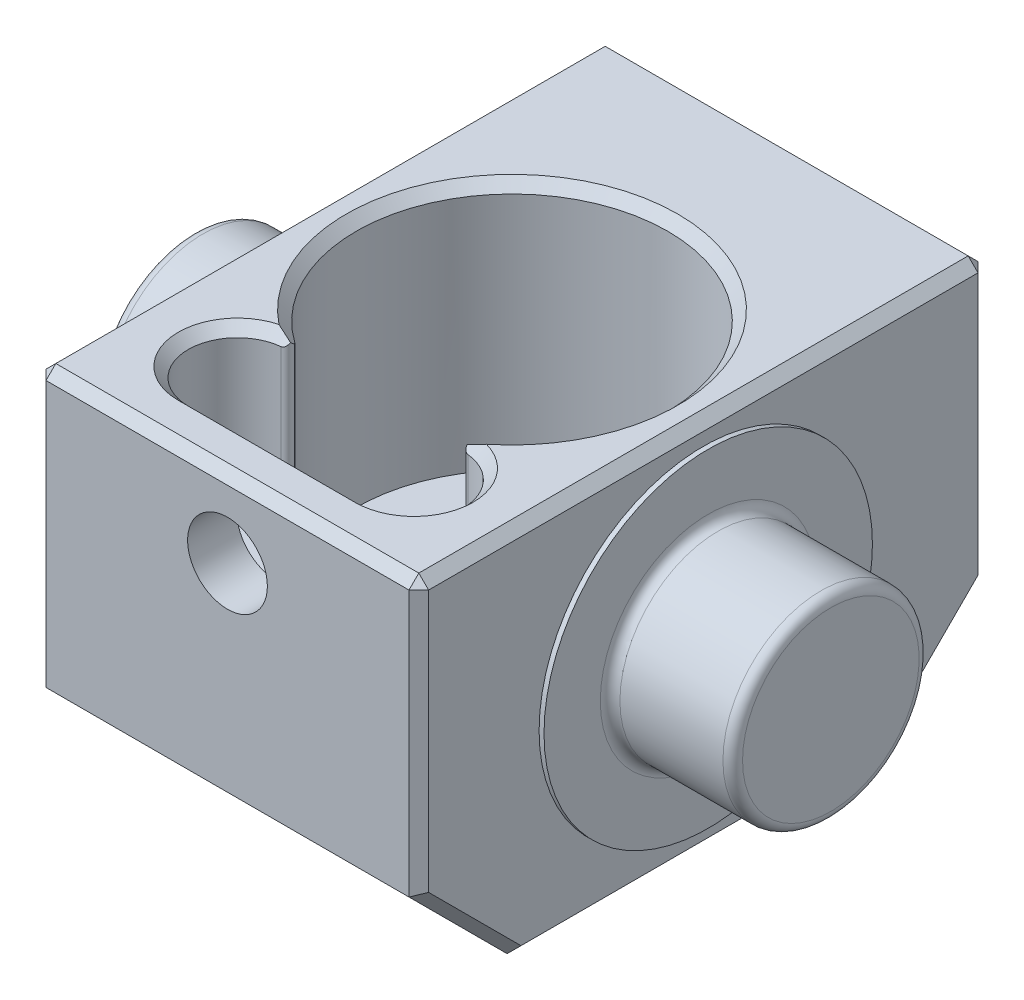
SolidWorks part; units mm, degrees
ref_plane "Front Plane" through (0, 0, 0) normal (0, 0, 1) x (1, 0, 0)
ref_plane "Top Plane" through (0, 0, 0) normal (0, 1, 0) x (1, 0, 0)
ref_plane "Right Plane" through (0, 0, 0) normal (1, 0, 0) x (0, 0, -1)
sketch "Sketch1" plane through (0, 0, 0) normal (1, 0, 0) x (0, 0, -1)
  line L1 (-14.5, 9.525) -> (14.5, 9.525)
  line L2 (-14.5, 9.525) -> (-14.5, -9.525)
  line L3 (-14.5, -9.525) -> (14.5, -9.525)
  line L4 (14.5, 9.525) -> (14.5, -9.525)
  line L5 (-14.5, 9.525) -> (14.5, -9.525) construction
  line L6 (-14.5, -9.525) -> (14.5, 9.525) construction
  point P0 (0, 0)
  dimension "D1" = 19.05
  dimension "D2" = 29
extrude "Boss-Extrude1" add sketch "Sketch1" along normal mid plane 19.5
sketch "Sketch2" plane through (0, 0, 0) normal (0, 0, 1) x (1, 0, 0)
  line L0 (0, 0) -> (15.0375, 0) construction
  line L1 (9.75, 8.3693) -> (10, 8.3693)
  line L2 (9.75, 9.525) -> (9.75, -9.525) construction
  line L3 (10, 8.3693) -> (10, 5)
  line L4 (10, 5) -> (16.25, 5)
  line L5 (16.25, 5) -> (16.25, 0)
  line L6 (16.25, 0) -> (9.75, 0)
  line L7 (9.75, 0) -> (9.75, 8.3693)
  line L8 (0, 10.193) -> (0, -1.9896) construction
  dimension "D1" = 16.7386
  dimension "D2" = 20
  dimension "D3" = 10
  dimension "D4" = 32.5
revolve "Revolve1" add sketch "Sketch2" angle 360 about L0
mirror "Mirror1" about plane through (0, 0, 0) normal (1, 0, 0) of "Revolve1"
sketch "Sketch3" plane through (0, 0, 0) normal (0, 0, 1) x (1, 0, 0)
  line L0 (0, 9.525) -> (0, -3.175)
  line L1 (9.75, 9.525) -> (-9.75, 9.525) construction
  line L2 (0, -3.175) -> (-7.9413, -3.175)
  line L3 (-7.9413, -3.175) -> (-7.9413, 9.525)
  line L4 (-7.9413, 9.525) -> (0, 9.525)
  line L5 (0, 10.1247) -> (0, -4.0859) construction
  dimension "D1" = 15.8826
  dimension "D2" = 3.175
revolve "Cut-Revolve1" cut sketch "Sketch3" angle 360 about L5
sketch "Sketch4" plane through (0, 0, 0) normal (0, 0, 1) x (1, 0, 0)
  line L0 (0, -9.525) -> (0, -3.175)
  line L1 (9.75, -9.525) -> (-9.75, -9.525) construction
  line L2 (0, -9.525) -> (-4.3688, -9.525)
  line L3 (-4.3688, -9.525) -> (-4.3688, -3.175)
  line L4 (7.9413, -3.175) -> (-7.9413, -3.175) construction
  line L5 (-4.3688, -3.175) -> (0, -3.175)
  line L6 (0, -1.9252) -> (0, -10.0139) construction
  dimension "D1" = 8.7376
revolve "Cut-Revolve2" cut sketch "Sketch4" angle 360 about L6
sketch "Sketch5" plane through (0, 9.525, 0) normal (0, 1, 0) x (1, 0, 0)
  line L0 (-4.5, -9.4958) -> (4.5, -9.4958) construction
  line L1 (-4.5, -6.9939) -> (4.5, -6.9939)
  line L2 (-4.5, -11.9977) -> (4.5, -11.9977)
  line L3 (-1.1729, 0) -> (1.6976, 0) construction
  arc A0 (-4.5, -6.9939) -> (-4.5, -11.9977) centre (-4.5, -9.4958) ccw
  arc A1 (4.5, -11.9977) -> (4.5, -6.9939) centre (4.5, -9.4958) ccw
  circle A4 centre (0, 0) radius 7.9413 construction
  point P2 (0, -9.4958)
  dimension "D1" = 14.9352
  dimension "D2" = 6.9939
  dimension "D3" = 5.0038
  dimension "D4" = 9
extrude "Cut-Extrude1" cut sketch "Sketch5" against normal blind 6.5
chamfer "Chamfer1" distance 5 angle 45 2 edges at (0, -9.525, -14.5) (0, -9.525, 14.5)
chamfer "Chamfer2" distance 0.5 angle 45 14 edges at (9.75, -7.025, 12) (9.75, 2.5, 14.5) (9.75, -9.525, 0) (9.75, -7.025, -12) (9.75, 2.5, -14.5) (-9.75, 2.5, 14.5) (-9.75, -7.025, 12) (-9.75, -9.525, 0) (-9.75, -7.025, -12) (-9.75, 2.5, -14.5) (0, 9.525, -14.5) (9.75, 9.525, 0) (0, 9.525, 14.5) (-9.75, 9.525, 0)
chamfer "Chamfer4" distance 0.508 angle 45 6 edges at (-4.1308, 9.525, 6.9939) (-7.0019, 9.525, 9.4958) (0, 9.525, 11.9977) (7.0019, 9.525, 9.4958) (4.1308, 9.525, 6.9939) (0, 9.525, -7.9413)
fillet "Fillet1" radius 0.3 2 edges at (3.7616, 6.021, 6.9939) (-3.7616, 6.021, 6.9939)
chamfer "Chamfer5" distance 0.5 angle 45 2 edges at (0, -3.175, 4.3688) (0, -9.525, 4.3688)
fillet "Fillet2" radius 0.5 2 edges at (-16.25, 0, 5) (16.25, 0, 5)
fillet "Fillet3" radius 0.5 2 edges at (10, 0, 5) (-10, 0, 5)
sketch "Sketch9" plane through (0, 0, 14.5) normal (0, 0, 1) x (1, 0, 0)
  line L0 (0, 3.025) -> (0, 9.525) construction
  line L1 (-4.5, 3.025) -> (4.5, 3.025) construction
  line L2 (-9.25, 9.525) -> (9.25, 9.525) construction
  circle A0 centre (0, 5.585) radius 2.032
  circle A1 centre (0, 5.585) radius 3.3274 construction
  dimension "D1" = 4.064
  dimension "D2" = 6.6548
  dimension "D3" = 3.94
extrude "Cut-Extrude2" cut sketch "Sketch9" against normal up to next
